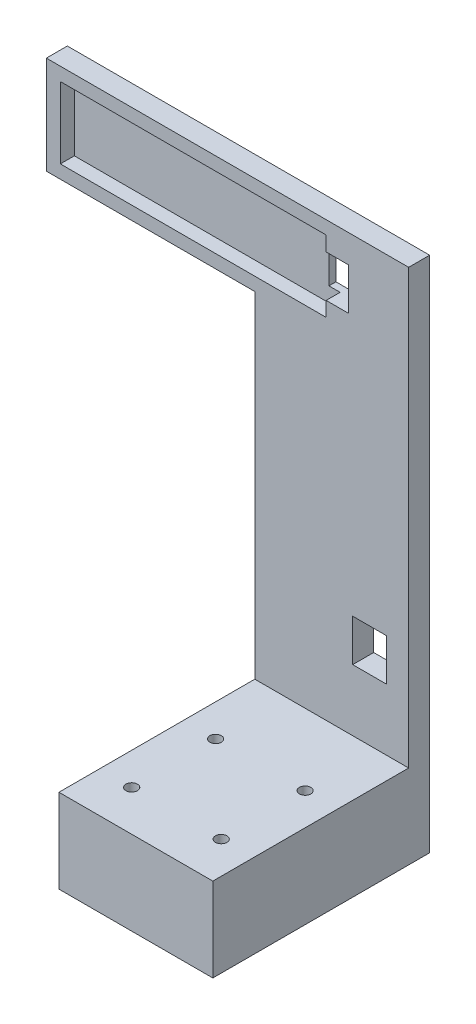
SolidWorks part; units mm, degrees
ref_plane "Alzado" through (0, 0, 0) normal (0, 0, 1) x (1, 0, 0)
ref_plane "Planta" through (0, 0, 0) normal (0, 1, 0) x (1, 0, 0)
ref_plane "Vista lateral" through (0, 0, 0) normal (1, 0, 0) x (0, 0, -1)
sketch "Sketch1" plane through (0, 0, 0) normal (0, 0, 1) x (1, 0, 0)
  line L1 (0, 0) -> (55, 0)
  line L2 (0, 0) -> (0, 150)
  line L3 (0, 150) -> (55, 150)
  line L4 (55, 0) -> (55, 150)
  line L5 (0, 0) -> (55, 150) construction
  line L6 (0, 150) -> (55, 0) construction
  line L7 (55, 150) -> (-74.5, 150)
  line L8 (55, 150) -> (55, 185)
  line L9 (55, 185) -> (-74.5, 185)
  line L10 (-74.5, 150) -> (-74.5, 185)
  line L11 (55, 150) -> (-74.5, 185) construction
  line L12 (55, 185) -> (-74.5, 150) construction
  point P4 (27.5, 75)
  point P9 (-9.75, 167.5)
  dimension "D1" = 35
  dimension "D2" = 55
  dimension "D3" = 74.5
  dimension "D4" = 150
extrude "Boss-Extrude1" add sketch "Sketch1" along normal blind 7.5 contours L10 L7 L3 L8 L9 | L1 L4 L3 L2
sketch "Sketch2" plane through (0, 0, 7.5) normal (0, 0, 1) x (1, 0, 0)
  line L0 (-74.5, 150) -> (-74.5, 185) construction
  line L1 (-69.5, 180.25) -> (25.5, 180.25)
  line L2 (-69.5, 180.25) -> (-69.5, 154.75)
  line L3 (-69.5, 154.75) -> (25.5, 154.75)
  line L4 (25.5, 180.25) -> (25.5, 154.75)
  line L5 (-69.5, 180.25) -> (25.5, 154.75) construction
  line L6 (-69.5, 154.75) -> (25.5, 180.25) construction
  point P4 (-22, 167.5)
  point P9 (-74.5, 167.5)
  dimension "D1" = 95
  dimension "D2" = 5
  dimension "D3" = 25.5
extrude "Cut-Extrude1" cut sketch "Sketch2" against normal blind 5
sketch "Sketch3" plane through (0, 0, 7.5) normal (0, 0, 1) x (1, 0, 0)
  line L0 (55, 0) -> (55, 185) construction
  line L1 (0, 0) -> (55, 0)
  line L2 (0, 0) -> (0, 30)
  line L3 (0, 30) -> (55, 30)
  line L4 (55, 0) -> (55, 30)
  line L5 (0, 0) -> (55, 30) construction
  line L6 (0, 30) -> (55, 0) construction
  point P4 (27.5, 15)
  dimension "D1" = 30
extrude "Boss-Extrude2" add sketch "Sketch3" along normal blind 70
sketch "Sketch5" plane through (0, 30, 0) normal (0, 1, 0) x (1, 0, 0)
  line L0 (55, -48) -> (0, -48) construction
  line L1 (55, -77.5) -> (55, -7.5) construction
  line L2 (0, -77.5) -> (0, -7.5) construction
  line L3 (55, -7.5) -> (0, -7.5) construction
  line L5 (11.5, -33) -> (43.5, -33) construction
  line L6 (11.5, -33) -> (11.5, -63) construction
  line L11 (11.5, -63) -> (43.5, -63) construction
  line L13 (43.5, -33) -> (43.5, -63) construction
  line L14 (11.5, -33) -> (43.5, -63) construction
  line L15 (11.5, -63) -> (43.5, -33) construction
  circle A0 centre (11.5, -33) radius 2.05
  circle A1 centre (11.5, -63) radius 2.05
  circle A2 centre (43.5, -63) radius 2.05
  circle A3 centre (43.5, -33) radius 2.05
  circle A4 centre (11.5, -63) radius 3.5 construction
  point P14 (27.5, -48)
  point P43 (27.5, -48)
  dimension "D4" = 4.1
  dimension "D5" = 7
  dimension "D1" = 40.5
  dimension "D2" = 32
  dimension "D3" = 30
extrude "Cut-Extrude2" cut sketch "Sketch5" against normal through all
sketch "Sketch6" plane through (0, 0, 0) normal (0, -1, 0) x (1, 0, 0)
  line L20 (5, 7.5) -> (50, 7.5)
  line L21 (0, 7.5) -> (-74.5, 7.5) construction
  line L23 (50, 0) -> (50, 72.5)
  line L24 (50, 72.5) -> (5, 72.5)
  line L25 (5, 72.5) -> (5, 0)
  line L26 (50, 7.5) -> (50, 72.5)
  line L27 (50, 72.5) -> (5, 72.5)
  line L28 (5, 72.5) -> (5, 7.5)
  dimension "D1" = 5
extrude "Cut-Extrude3" cut sketch "Sketch6" against normal blind 25
sketch "Sketch7" plane through (0, 0, 7.5) normal (0, 0, 1) x (1, 0, 0)
  line L5 (25.5, 154.75) -> (25.5, 180.25) construction
  line L6 (21.5, 175) -> (33.5, 175)
  line L7 (55, 30) -> (0, 30) construction
  line L8 (35, 67) -> (47, 67)
  line L9 (35, 67) -> (35, 52)
  line L10 (35, 52) -> (47, 52)
  line L11 (47, 67) -> (47, 52)
  line L12 (35, 67) -> (47, 52) construction
  line L13 (35, 52) -> (47, 67) construction
  line L17 (21.5, 175) -> (21.5, 160)
  line L18 (21.5, 160) -> (33.5, 160)
  line L19 (33.5, 175) -> (33.5, 160)
  line L20 (21.5, 175) -> (33.5, 160) construction
  line L21 (21.5, 160) -> (33.5, 175) construction
  line L22 (55, 30) -> (55, 185) construction
  point P0 (27.5, 167.5)
  point P5 (41, 59.5)
  point P15 (25.5, 167.5)
  dimension "D1" = 12
  dimension "D2" = 15
  dimension "D3" = 12
  dimension "D4" = 15
  dimension "D5" = 22
  dimension "D6" = 8
  dimension "D7" = 27.5
extrude "Cut-Extrude4" cut sketch "Sketch7" against normal through all
sketch "Sketch8" plane through (0, 0, 0) normal (0, 0, -1) x (-1, 0, 0)
  line L11 (0, 0) -> (-55, 0) construction
  line L12 (-54, 147.25) -> (-1, 147.25) construction
  line L13 (-54, 147.25) -> (-54, 79.75) construction
  line L14 (-54, 79.75) -> (-1, 79.75) construction
  line L15 (-1, 147.25) -> (-1, 79.75) construction
  line L16 (-54, 147.25) -> (-1, 79.75) construction
  line L17 (-54, 79.75) -> (-1, 147.25) construction
  line L18 (-47, 67) -> (-35, 67) construction
  circle A0 centre (-52, 133.25) radius 1.55
  circle A1 centre (-3, 132.25) radius 1.55
  circle A2 centre (-18.5, 82.25) radius 1.55
  circle A3 centre (-46.5, 82.25) radius 1.55
  point P9 (-27.5, 113.5)
  point P17 (-27.5, 0)
  dimension "D2" = 3.1
  dimension "D5" = 14
  dimension "D3" = 15
  dimension "D4" = 2
  dimension "D6" = 2
  dimension "D7" = 2.5
  dimension "D8" = 53
  dimension "D9" = 67.5
  dimension "D10" = 46.5
  dimension "D11" = 2.5
  dimension "D12" = 7.5
  dimension "D13" = 17.5
extrude "Cut-Extrude5" cut sketch "Sketch8" against normal blind 4
ref_plane "Plano1" through (0, 167.5, 0) normal (0, -1, 0) x (-1, 0, 0)
sketch "Croquis2" plane through (0, 0, 0) normal (0, 0, -1) x (-1, 0, 0)
  line L0 (74.5, 172.2999) -> (17.0164, 172.2999) construction
  line L1 (74.5, 150) -> (74.5, 185) construction
  line L2 (74.5, 159.517) -> (17.0164, 159.517) construction
  text T0 "Fávell Núñez" font "Century Gothic" height in points 20
  text T1 "Geo Fortín" font "Century Gothic" height in points 20
extrude "Cortar-Extruir1" cut sketch "Croquis2" against normal blind 2
